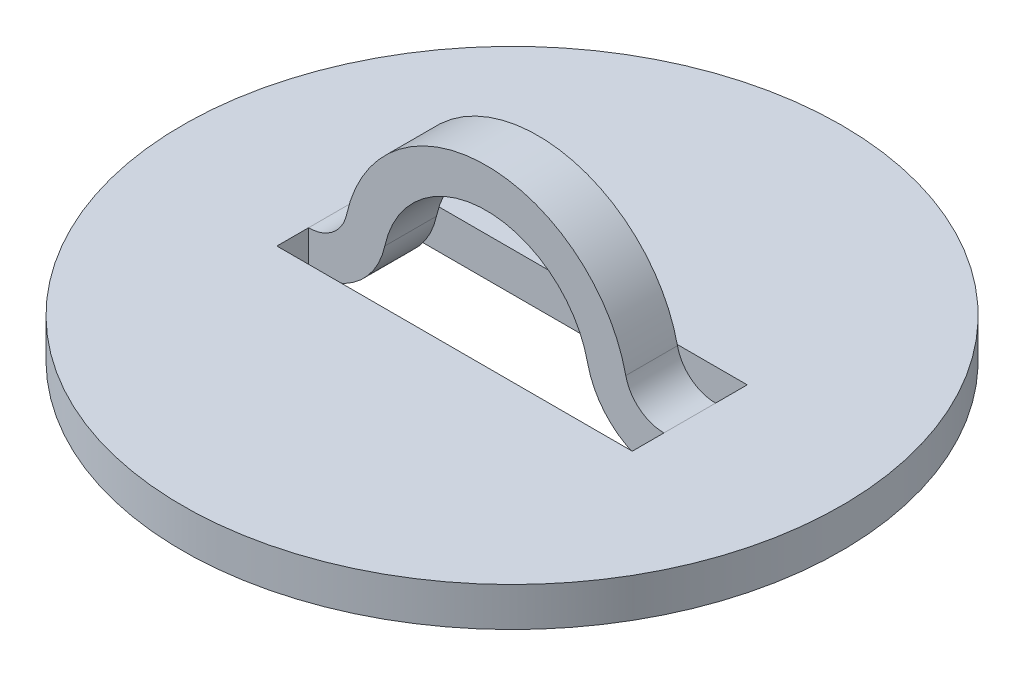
SolidWorks part; units mm, degrees
ref_plane "Front Plane" through (0, 0, 0) normal (0, 0, 1) x (1, 0, 0)
ref_plane "Top Plane" through (0, 0, 0) normal (0, 1, 0) x (1, 0, 0)
ref_plane "Right Plane" through (0, 0, 0) normal (1, 0, 0) x (0, 0, -1)
sketch "Sketch1" plane through (0, 0, 0) normal (0, 0, 1) x (1, 0, 0)
  line L0 (-15.875, 0) -> (-8.559, 0)
  line L1 (0, 0) -> (0, -26.7494) construction
  line L2 (-15.875, 6.8834) -> (15.875, 6.8834) construction
  line L3 (8.559, 0) -> (15.875, 0)
  line L4 (-15.875, -1.8796) -> (-8.559, -1.8796)
  line L5 (-15.875, 0) -> (15.875, 0) construction
  line L6 (8.559, -1.8796) -> (15.875, -1.8796)
  line L7 (-15.875, 5.0038) -> (15.875, 5.0038) construction
  line L8 (-15.875, 0) -> (-15.875, -1.8796)
  line L9 (15.875, 0) -> (15.875, -1.8796)
  arc A0 (6.7232, 1.4764) -> (-6.7232, 1.4764) centre (0, 0) ccw
  arc A1 (8.559, 0) -> (6.7232, 1.4764) centre (8.559, 1.8796) cw
  arc A2 (-8.559, 0) -> (-6.7232, 1.4764) centre (-8.559, 1.8796) ccw
  arc A3 (-8.559, -1.8796) -> (-4.8873, 1.0733) centre (-8.559, 1.8796) ccw
  arc A4 (4.8873, 1.0733) -> (-4.8873, 1.0733) centre (0, 0) ccw
  arc A5 (8.559, -1.8796) -> (4.8873, 1.0733) centre (8.559, 1.8796) cw
  dimension "D3" = 1.8796
  dimension "D1" = 31.75
  dimension "D2" = 6.8834
  dimension "D4" = 1.8796
extrude "Boss-Extrude1" add sketch "Sketch1" along normal blind 2.4892
sketch "Sketch2" plane through (0, -1.8796, 0) normal (0, -1, 0) x (1, 0, 0)
  line L0 (0, 2.4892) -> (0, 0) construction
  line L1 (4.8873, 2.4892) -> (-4.8873, 2.4892) construction
  line L2 (8.559, 2.4892) -> (15.875, 2.4892) construction
  line L3 (-11.734, -1.524) -> (11.734, -1.524)
  line L4 (-11.734, -1.524) -> (-11.734, 4.0132)
  line L5 (-11.734, 4.0132) -> (11.734, 4.0132)
  line L6 (11.734, -1.524) -> (11.734, 4.0132)
  line L7 (-11.734, -1.524) -> (11.734, 4.0132) construction
  line L8 (-11.734, 4.0132) -> (11.734, -1.524) construction
  line L9 (8.559, 2.4892) -> (8.559, 0) construction
  circle A0 centre (0, 1.2446) radius 15.875
  point P13 (11.6751, -1.524)
  dimension "D1" = 1.524
  dimension "D2" = 3.175
extrude "Boss-Extrude2" add sketch "Sketch2" against normal up to vertex
other "DeleteFace1"
sketch "Sketch4" plane through (-11.734, 0, 0) normal (1, 0, 0) x (0, 0, -1)
  line L4 (-2.4892, -1.8796) -> (-2.4892, 0)
  line L5 (-2.4892, 0) -> (-4.0132, 0)
  line L6 (-4.0132, 0) -> (-4.0132, -1.8796)
  line L7 (-4.0132, -1.8796) -> (-2.4892, -1.8796)
  line L8 (-2.4892, -1.8796) -> (-2.4892, 0)
  line L9 (-2.4892, 0) -> (-4.0132, 0)
  line L10 (-4.0132, 0) -> (-4.0132, -1.8796)
  line L11 (-4.0132, -1.8796) -> (-2.4892, -1.8796)
  line L12 (1.524, 0) -> (0, 0)
  line L13 (0, 0) -> (0, -1.8796)
  line L14 (0, -1.8796) -> (1.524, -1.8796)
  line L15 (1.524, -1.8796) -> (1.524, 0)
  line L16 (1.524, 0) -> (0, 0)
  line L17 (0, 0) -> (0, -1.8796)
  line L18 (0, -1.8796) -> (1.524, -1.8796)
  line L19 (1.524, -1.8796) -> (1.524, 0)
  dimension "D1" = 0
  dimension "D2" = 0
extrude "Boss-Extrude3" add sketch "Sketch4" along normal up to vertex
sketch "Sketch5" plane through (11.734, 0, 0) normal (-1, 0, 0) x (0, 0, 1)
  line L4 (2.4892, 0) -> (2.4892, -1.8796)
  line L5 (2.4892, -1.8796) -> (4.0132, -1.8796)
  line L6 (4.0132, -1.8796) -> (4.0132, 0)
  line L7 (4.0132, 0) -> (2.4892, 0)
  line L8 (2.4892, 0) -> (2.4892, -1.8796)
  line L9 (2.4892, -1.8796) -> (4.0132, -1.8796)
  line L10 (4.0132, -1.8796) -> (4.0132, 0)
  line L11 (4.0132, 0) -> (2.4892, 0)
  line L12 (-1.524, -1.8796) -> (0, -1.8796)
  line L13 (0, -1.8796) -> (0, 0)
  line L14 (0, 0) -> (-1.524, 0)
  line L15 (-1.524, 0) -> (-1.524, -1.8796)
  line L16 (-1.524, -1.8796) -> (0, -1.8796)
  line L17 (0, -1.8796) -> (0, 0)
  line L18 (0, 0) -> (-1.524, 0)
  line L19 (-1.524, 0) -> (-1.524, -1.8796)
  dimension "D1" = 0
  dimension "D2" = 0
extrude "Boss-Extrude4" add sketch "Sketch5" along normal up to vertex
